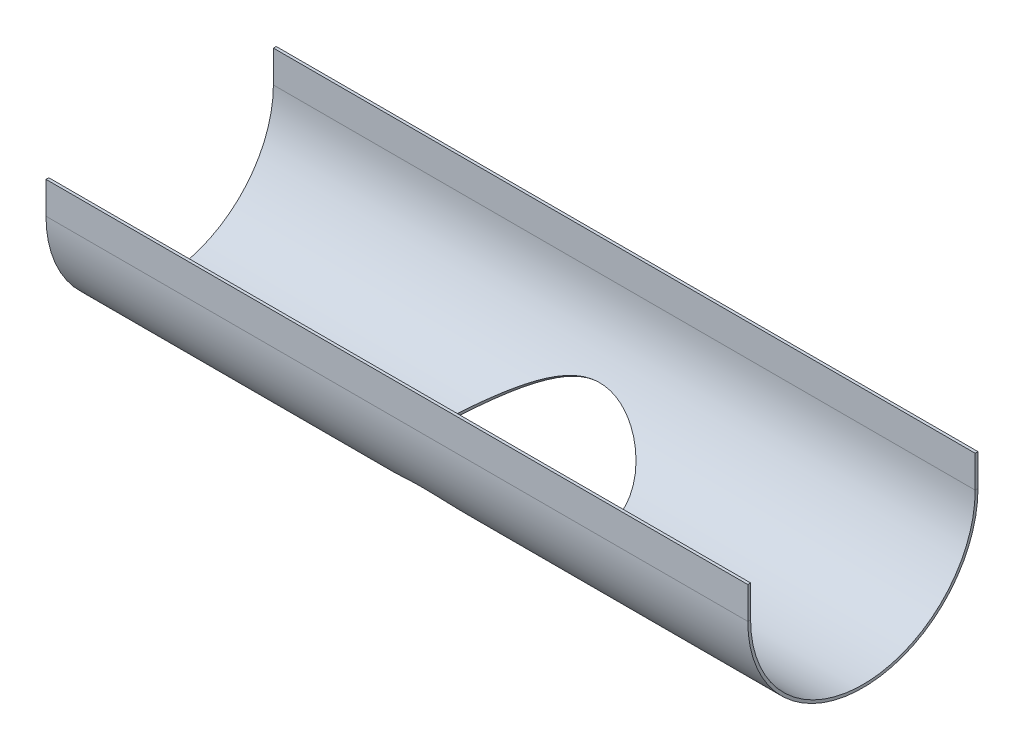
SolidWorks part; units mm, degrees
ref_plane "Ebene vorne" through (0, 0, 0) normal (0, 0, 1) x (1, 0, 0)
ref_plane "Ebene oben" through (0, 0, 0) normal (0, 1, 0) x (1, 0, 0)
ref_plane "Ebene rechts" through (0, 0, 0) normal (1, 0, 0) x (0, 0, -1)
sketch "Skizze1" plane through (0, 0, 0) normal (0, 0, 1) x (1, 0, 0)
  line L1 (-250, 150) -> (250, 150)
  line L2 (-250, 150) -> (-250, -150)
  line L3 (-250, -150) -> (250, -150)
  line L4 (250, 150) -> (250, -150)
  line L5 (-250, 150) -> (250, -150) construction
  line L6 (-250, -150) -> (250, 150) construction
  point P0 (0, 0)
  dimension "D1" = 500
  dimension "D2" = 300
sheet metal parameters "Blech1" thickness 2 parameters "D1"=5, "Dicke"=2
base flange "Basis-Blech1" sketch "Skizze1" thickness 2 reverse thickness direction yes parameters "D1"=5
sketch "Skizze5" plane through (0, 0, 0) normal (0, 0, -1) x (-1, 0, 0)
  line L0 (-250, 0) -> (250, 0)
  line L1 (-250, -150) -> (-250, 150) construction
  line L2 (250, 150) -> (250, -150) construction
sketched bend "Skizzierte Biegung6" parameters "D1"=80
bend "Skizzenbiegung6" bend radius 80 bend angle 180 parameters "D5"=1
sketch "Skizze7" plane through (0, 150, 0) normal (0, 1, 0) x (1, 0, 0)
  line L0 (-250, 80) -> (250, 80) construction
  line L1 (-250, 160) -> (-250, 0) construction
  line L2 (250, 0) -> (250, 160) construction
  line L3 (0, 160) -> (0, 0) construction
  line L4 (250, 160) -> (-250, 160) construction
  circle A0 centre (0, 80) radius 62.5
  dimension "D1" = 125
extrude "Linear austragen1" cut sketch "Skizze7" against normal through all
flat pattern "Abwicklung1"
sketch "Biegung-Linien1" plane through (0, 0, 0) normal (0, 1, 0) x (-1, 0, 0)
bend of the flat pattern "Abwickeln-<Skizzenbiegung6>1"
